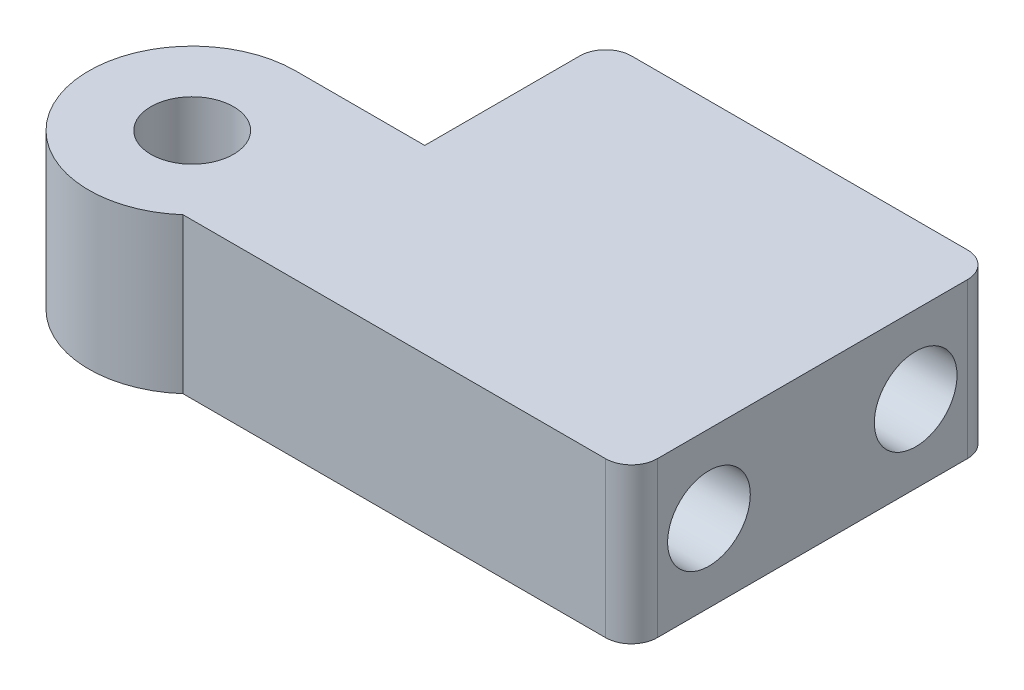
SolidWorks part; units mm, degrees
ref_plane "Front" through (0, 0, 0) normal (0, 0, 1) x (1, 0, 0)
ref_plane "Top" through (0, 0, 0) normal (0, 1, 0) x (1, 0, 0)
ref_plane "Right" through (0, 0, 0) normal (1, 0, 0) x (0, 0, -1)
sketch "草图1" plane through (0, 0, 0) normal (0, 1, 0) x (1, 0, 0)
  line L0 (0, 0) -> (20, 0)
  line L1 (0, -3) -> (20, -3)
  line L2 (5, 11) -> (20, 11)
  line L3 (20, 11) -> (20, -3)
  line L5 (5, 11) -> (5, 4)
  line L6 (5, 4) -> (0, 4)
  line L7 (0, 11) -> (20, 11) construction
  circle A0 centre (0, 0) radius 1.6
  circle A1 centre (0, 0) radius 4
  dimension "D3" = 3.2
  dimension "D4" = 8
  dimension "D5" = 20
  dimension "D6" = 5
  dimension "D1" = 3
  dimension "D2" = 11
extrude "凸台-拉伸1" add sketch "草图1" along normal blind 6
sketch "草图2" plane through (20, 0, 0) normal (1, 0, 0) x (0, 0, -1)
  line L0 (11, 0) -> (-3, 0) construction
  line L1 (-3, 6) -> (-3, 0) construction
  line L2 (11, 6) -> (11, 0) construction
  circle A0 centre (8, 3) radius 1.6
  circle A1 centre (0, 3) radius 1.6
  dimension "D1" = 3
  dimension "D5" = 3.2
  dimension "D6" = 3.2
  dimension "D2" = 3
  dimension "D3" = 3
  dimension "D4" = 3
extrude "切除-拉伸1" cut sketch "草图2" against normal blind 10
fillet "圆角1" radius 1 3 edges at (20, 3, 3) (20, 3, -11) (5, 3, -11)
